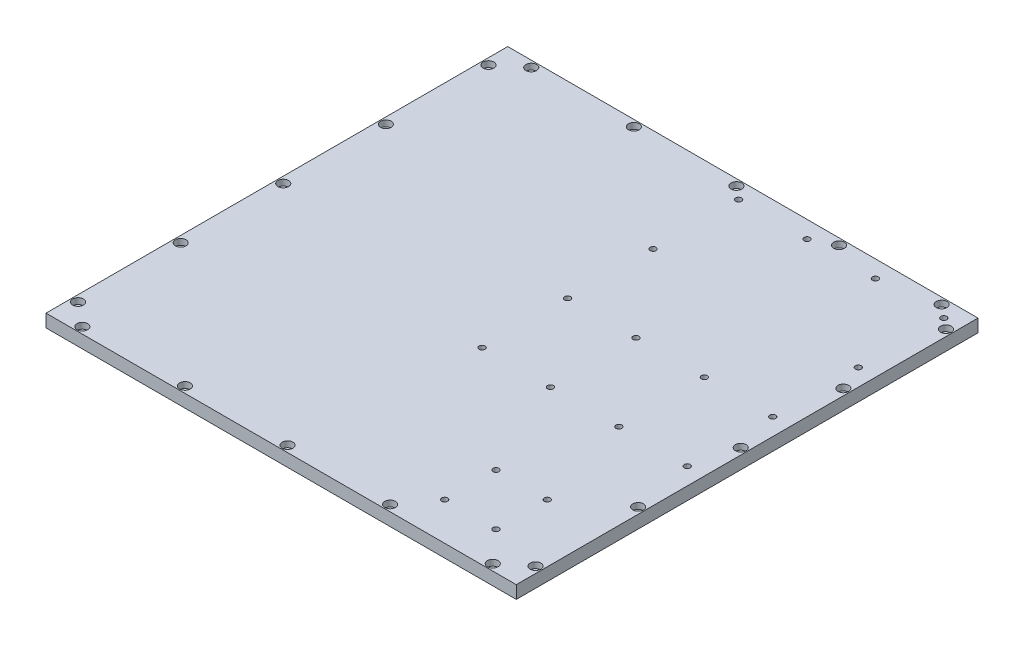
SolidWorks part; units mm, degrees
ref_plane "Front Plane" through (0, 0, 0) normal (0, 0, 1) x (1, 0, 0)
ref_plane "Top Plane" through (0, 0, 0) normal (0, 1, 0) x (1, 0, 0)
ref_plane "Right Plane" through (0, 0, 0) normal (1, 0, 0) x (0, 0, -1)
sketch "Sketch1" plane through (0, 0, 0) normal (0, 1, 0) x (1, 0, 0)
  line L1 (-174.625, 171.45) -> (174.625, 171.45)
  line L2 (-174.625, 171.45) -> (-174.625, -171.45)
  line L3 (-174.625, -171.45) -> (174.625, -171.45)
  line L4 (174.625, 171.45) -> (174.625, -171.45)
  line L5 (-174.625, 171.45) -> (174.625, -171.45) construction
  line L6 (-174.625, -171.45) -> (174.625, 171.45) construction
  point P0 (0, 0)
  dimension "D1" = 342.9
  dimension "D2" = 349.25
extrude "Boss-Extrude1" add sketch "Sketch1" along normal blind 9.525
sketch "Sketch2" plane through (0, 9.525, 0) normal (0, 1, 0) x (1, 0, 0)
  line L0 (-169.8625, 166.6875) -> (-169.8625, -166.6875) construction
  line L1 (-174.625, 171.45) -> (-174.625, -171.45) construction
  line L2 (-169.8625, 166.6875) -> (169.8625, 166.6875) construction
  line L3 (174.625, 171.45) -> (-174.625, 171.45) construction
  line L4 (169.8625, 166.6875) -> (169.8625, -166.6875) construction
  line L5 (174.625, -171.45) -> (174.625, 171.45) construction
  line L6 (-169.8625, -166.6875) -> (169.8625, -166.6875) construction
  line L7 (-174.625, -171.45) -> (174.625, -171.45) construction
  line L8 (0, 166.6875) -> (0, -166.6875) construction
  line L9 (-169.8625, 0) -> (169.8625, 0) construction
  circle A1 centre (0, -166.6875) radius 3.9687 construction
  circle A2 centre (76.2, -166.6875) radius 3.9688 construction
  circle A3 centre (152.4, -166.6875) radius 3.9688 construction
  circle A5 centre (-76.2, -166.6875) radius 3.9688 construction
  circle A6 centre (-152.4, -166.6875) radius 3.9688 construction
  circle A8 centre (-169.8625, 0) radius 4.6717 construction
  circle A9 centre (-169.8625, 76.2) radius 4.6717 construction
  circle A10 centre (-169.8625, 152.4) radius 4.6717 construction
  circle A12 centre (-169.8625, -76.2) radius 4.6717 construction
  circle A13 centre (-169.8625, -152.4) radius 4.6717 construction
  circle A15 centre (169.8625, -152.4) radius 4.6717 construction
  circle A16 centre (169.8625, -152.4) radius 4.6717 construction
  circle A17 centre (169.8625, -76.2) radius 4.6717 construction
  circle A18 centre (169.8625, 152.4) radius 4.6717 construction
  circle A19 centre (169.8625, 152.4) radius 4.6717 construction
  circle A20 centre (169.8625, 76.2) radius 4.6717 construction
  circle A21 centre (169.8625, 0) radius 4.6717 construction
  circle A22 centre (-152.4, 166.6875) radius 3.9687 construction
  circle A23 centre (-76.2, 166.6875) radius 3.9687 construction
  circle A24 centre (152.4, 166.6875) radius 3.9687 construction
  circle A25 centre (152.4, 166.6875) radius 3.9687 construction
  circle A26 centre (76.2, 166.6875) radius 3.9687 construction
  circle A27 centre (0, 166.6875) radius 3.9687 construction
  circle A28 centre (-152.4, 166.6875) radius 3.9687
  dimension "D5" = 7.9375
  dimension "D1" = 4.7625
  dimension "D2" = 4.7625
  dimension "D3" = 4.7625
  dimension "D4" = 4.7625
  dimension "D6" = 3
  dimension "D7" = 3
  dimension "D8" = 3
  dimension "D9" = 3
hole_wizard "CBORE for #8 Binding Head Machine Screw1" positions "Sketch3" profile "Sketch4" counterbore size "#8" standard "ANSI Inch"
sketch "Sketch3" plane through (0, 9.525, 0) normal (0, 1, 0) x (1, 0, 0)
  point P0 (-152.4, 166.6875)
  point P3 (-169.8625, 152.4)
  point P6 (-169.8625, 152.4)
  point P9 (-152.4, 166.6875)
  point P12 (-76.2, 166.6875)
  point P15 (0, 166.6875)
  point P18 (76.2, 166.6875)
  point P21 (152.4, 166.6875)
  point P24 (152.4, 166.6875)
  point P27 (169.8625, 152.4)
  point P30 (169.8625, 152.4)
  point P33 (169.8625, 76.2)
  point P36 (169.8625, 0)
  point P39 (169.8625, -76.2)
  point P42 (169.8625, -152.4)
  point P45 (169.8625, -152.4)
  point P48 (152.4, -166.6875)
  point P51 (152.4, -166.6875)
  point P54 (76.2, -166.6875)
  point P57 (-152.4, -166.6875)
  point P60 (-152.4, -166.6875)
  point P63 (-76.2, -166.6875)
  point P66 (0, -166.6875)
  point P69 (-169.8625, -152.4)
  point P72 (-169.8625, -152.4)
  point P75 (-169.8625, -76.2)
  point P78 (-169.8625, 0)
  point P81 (-169.8625, 76.2)
sketch "Sketch4" plane through (-152.4, 9.525, -166.6875) normal (1, 0, 0) x (0, 0, 1)
  line L0 (0, 0) -> (0, 9.525)
  line L1 (0, 9.525) -> (2.1526, 9.525)
  line L3 (2.1526, 9.525) -> (2.1527, 4.4196)
  line L4 (2.1527, 4.4196) -> (3.9687, 4.4196)
  line L5 (3.9687, 4.4196) -> (3.9687, 0)
  line L7 (3.9687, 0) -> (0, 0)
  line L11 (0, -6.35) -> (0, 107.95) construction
  dimension "Thru Hole Dia." = 4.3053
  dimension "Thru Hole Depth" = 9.525
  dimension "C'Bore Dia." = 7.9375
  dimension "C'Bore Depth" = 4.4196
sketch "Sketch5" plane through (0, 9.525, 0) normal (0, 1, 0) x (1, 0, 0)
  circle A0 centre (9.525, 158.75) radius 2.1971
  circle A1 centre (60.325, 158.75) radius 2.1971
  circle A2 centre (111.125, 158.75) radius 2.1971
  circle A3 centre (9.525, 95.25) radius 2.1971
  circle A4 centre (9.525, 31.75) radius 2.1971
  circle A5 centre (161.925, 158.75) radius 2.1971
  circle A6 centre (60.325, 31.75) radius 2.1971
  circle A7 centre (111.125, 31.75) radius 2.1971
  circle A8 centre (161.925, 31.75) radius 2.1971
  circle A9 centre (9.525, -31.75) radius 2.1971
  circle A10 centre (60.325, -31.75) radius 2.1971
  circle A11 centre (111.125, -31.75) radius 2.1971
  circle A12 centre (161.925, -31.75) radius 2.1971
  circle A13 centre (161.925, 95.25) radius 2.1971
extrude "Cut-Extrude1" cut sketch "Sketch5" against normal through all
ref_plane "Plane1" through (93.8022, -0.9906, 161.1122) normal (-1, 0, 0) x (0, 0, 1)
sketch "Sketch7" plane through (0, 9.525, 0) normal (0, 1, 0) x (1, 0, 0)
  circle A0 centre (93.353, -143.3721) radius 2.1971
  circle A1 centre (131.453, -143.3721) radius 2.1971
  circle A2 centre (93.353, -105.2721) radius 2.1971
  circle A3 centre (131.453, -105.2721) radius 2.1971
extrude "Cut-Extrude2" cut sketch "Sketch7" against normal through all
